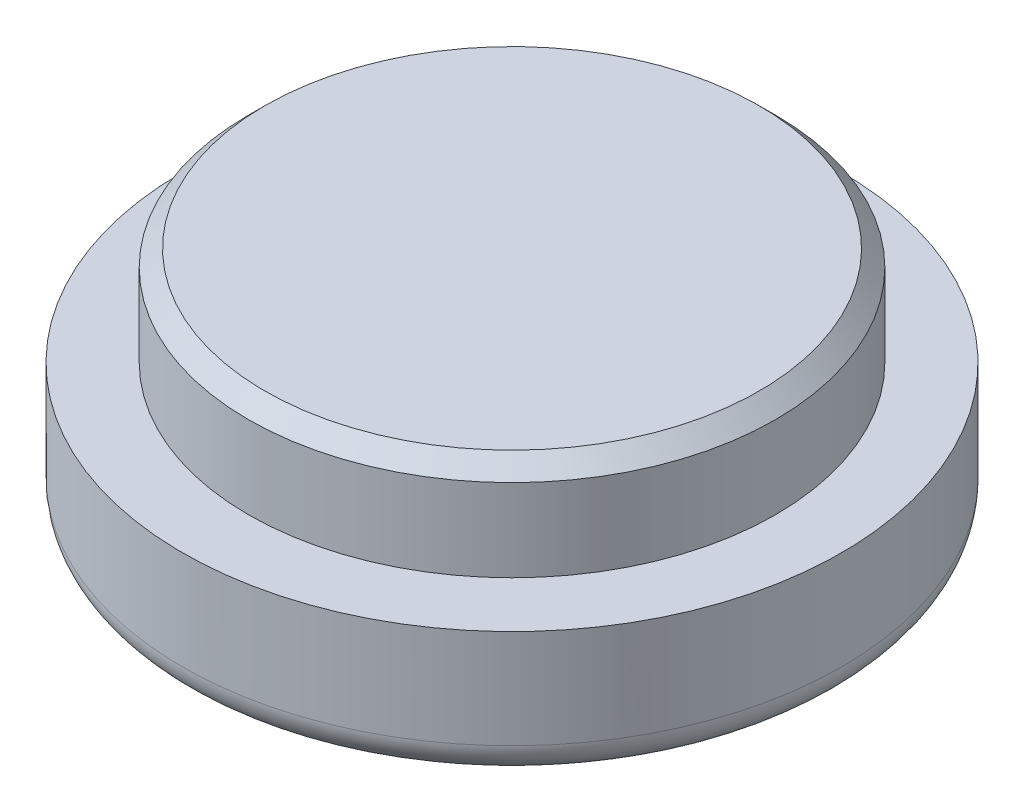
SolidWorks part; units mm, degrees
ref_plane "Plan de face" through (0, 0, 0) normal (0, 0, 1) x (1, 0, 0)
ref_plane "Plan de dessus" through (0, 0, 0) normal (0, 1, 0) x (1, 0, 0)
ref_plane "Plan de droite" through (0, 0, 0) normal (1, 0, 0) x (0, 0, -1)
sketch "Esquisse1" plane through (0, 0, 0) normal (0, 0, 1) x (1, 0, 0)
  line L0 (0, 16.3779) -> (0, -6.8211) construction
  line L2 (0, 3) -> (-8, 3)
  line L3 (-8, 220) -> (-8, 0) construction
  line L4 (-8, 3) -> (-8, 0)
  line L5 (-8, 0) -> (8, 0) construction
  line L6 (-8, 0) -> (-10, 0)
  line L7 (-10, 0) -> (10, 0) construction
  line L8 (-10, 0) -> (-10, -4)
  line L9 (-10, -4) -> (0, -4)
  line L10 (0, -4) -> (0, 3)
  line L11 (-10, 220) -> (-10, 0) construction
  line L12 (10, 0) -> (10, 220) construction
  dimension "D1" = 4
  dimension "D2" = 3
revolve "Révolution1" add sketch "Esquisse1" angle 360 about L0
fillet "Congé1" radius 1 1 edges at (-10, -4, 0)
chamfer "Chanfrein1" distance 0.5 angle 45 1 edges at (-8, 3, 0)
